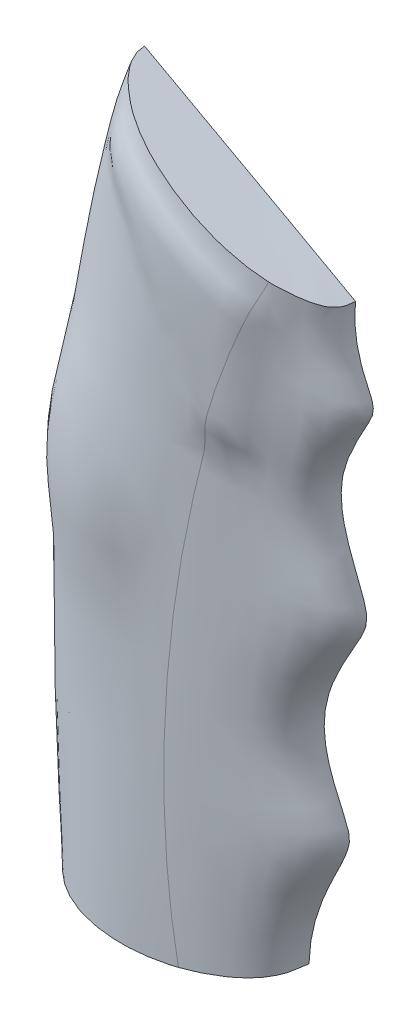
SolidWorks part; units mm, degrees
ref_plane "Front Plane" through (0, 0, 0) normal (0, 0, 1) x (1, 0, 0)
ref_plane "Top Plane" through (0, 0, 0) normal (0, 1, 0) x (1, 0, 0)
ref_plane "Right Plane" through (0, 0, 0) normal (1, 0, 0) x (0, 0, -1)
sketch "Sketch1" plane through (0, 0, 0) normal (0, 0, 1) x (1, 0, 0)
  line L0 (14.5622, 178) -> (67.2748, 149.1066) construction
  spline S0 degree 3 poles (0, 0) (0.2864, 5.7654) (-11.0177, 84.9484) (11.4102, 172.6093) (14.5622, 178) knots 0 0 0 0 0.657313 1 1 1 1
  spline S1 degree 3 poles (55.63, 4.8929) (57.1391, 33.5819) (59.6738, 81.767) (65.0853, 129.7089) (67.2748, 149.1066) knots 0 0 0 0 0.59539 1 1 1 1
  dimension "D1" = 178
sketch "Sketch2" plane through (0, 0, 0) normal (0, 1, 0) x (1, 0, 0)
  line L0 (55.63, 0) -> (0, 0)
  ellipse E0 centre (27.815, 0) end of major axis (0, 0) minor radius 19 (0, 0) -> (55.63, 0) ccw
  dimension "D1" = 19
ref_plane "Plane1" through (78.3902, 143.014, 0) normal (-0.4807, -0.8769, 0) x (0.8769, -0.4807, 0)
sketch "Sketch3" plane through (78.3902, 143.014, 0) normal (-0.4807, -0.8769, 0) x (0.8769, -0.4807, 0)
  line L1 (-12.6756, 0) -> (-72.7876, 0)
  ellipse E0 centre (-42.7316, 0) end of major axis (-72.7876, 0) minor radius 15.25 (-72.7876, 0) -> (-12.6756, 0) cw
  dimension "D1" = 15.25
loft "Loft1" add profiles "Sketch2", "Sketch3"
sketch "Finger Grip" plane through (0, 0, 0) normal (0, 0, -1) x (-1, 0, 0)
  spline S0 degree 3 poles (-55.63, 0) (-55.6701, 0.787) (-56.4546, 16.2063) (-66.0365, 26.9063) (-65.5605, 36.0185) (-59.2274, 44.3172) (-59.6992, 66.1996) (-69.7325, 75.8774) (-70.414, 87.0102) (-56.2065, 105.5489) (-71.69, 125.1392) (-71.927, 130.6446) (-66.2233, 136.924) (-67.2243, 148.5171) (-67.2748, 149.1066) knots 0 0 0 0 0.010904 0.218082 0.218082 0.363536 0.363536 0.550014 0.550014 0.731464 0.859835 0.859835 0.992992 1 1 1 1
sketch "Thumb Rest" plane through (0, 0, 0) normal (0, 0, 1) x (1, 0, 0)
  line L0 (15.831, 163.7869) -> (19.6139, 170.7364)
  line L1 (19.6139, 170.7364) -> (56.1001, 150.8757)
  line L2 (56.1001, 150.8757) -> (54.2323, 114.9515)
  line L3 (54.2323, 114.9515) -> (43.5704, 118.4118)
  line L4 (43.5704, 118.4118) -> (15.831, 163.7869) construction
  arc A0 (43.5704, 118.4118) -> (15.831, 163.7869) centre (-28.4952, 105.522) ccw
  dimension "D1" = 120
  dimension "D2" = 5
sketch "Split Sketch" plane through (0, 0, 0) normal (0, 0, 1) x (1, 0, 0)
  arc A0 (62.2976, 166.0047) -> (44.719, -24.8157) centre (344.0262, 43.8317) ccw
sketch3d "3DSketch1"
  point P0 (13.9458, 96.7791, 14.9262)
other "Deform1" parameters "D1"=3.8, "D2"=63.5
other "Deform2" parameters "D1"=3.8, "D2"=63.5
surface "Surface-Knit1"
extrude "Boss-Extrude1" add sketch "Thumb Rest" along normal offset from surface (18.1887 mm away) 2.5 separate body
other "Deform3" parameters "D1"=3.8, "D2"=63.5
